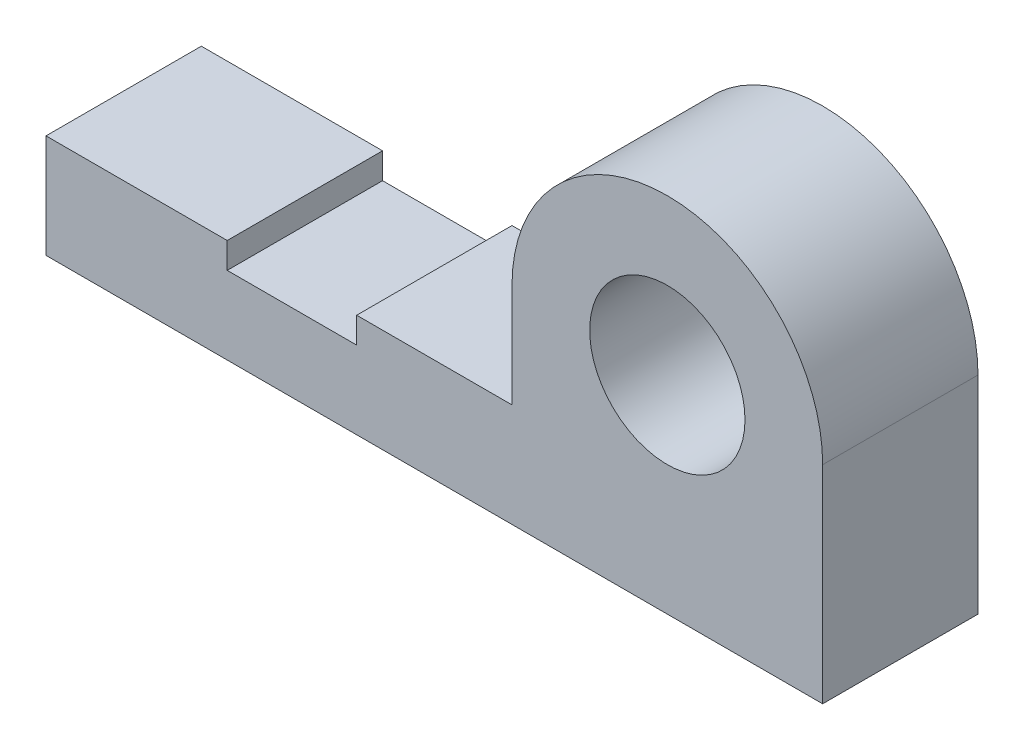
SolidWorks part; units mm, degrees
ref_plane "Front Plane" through (0, 0, 0) normal (0, 0, 1) x (1, 0, 0)
ref_plane "Top Plane" through (0, 0, 0) normal (0, 1, 0) x (1, 0, 0)
ref_plane "Right Plane" through (0, 0, 0) normal (1, 0, 0) x (0, 0, -1)
sketch "Sketch1" plane through (0, 0, 0) normal (0, 0, 1) x (1, 0, 0)
  line L0 (0, 0) -> (150, 0)
  line L1 (150, 0) -> (150, 40)
  line L2 (90, 40) -> (90, 20)
  line L3 (90, 20) -> (60, 20)
  line L4 (60, 20) -> (60, 15)
  line L5 (60, 15) -> (35, 15)
  line L6 (35, 15) -> (35, 20)
  line L7 (35, 20) -> (0, 20)
  line L8 (0, 20) -> (0, 0)
  arc A0 (150, 40) -> (90, 40) centre (120, 40) ccw
  circle A1 centre (120, 40) radius 15
  dimension "D2" = 30
  dimension "D3" = 30
  dimension "D1" = 150
  dimension "D4" = 40
  dimension "D5" = 20
  dimension "D6" = 15
  dimension "D7" = 25
  dimension "D8" = 35
extrude "Boss-Extrude1" add sketch "Sketch1" along normal blind 30 contours A1 | A0 L2 L3 L4 L5 L6 L7 L8 L0 L1
